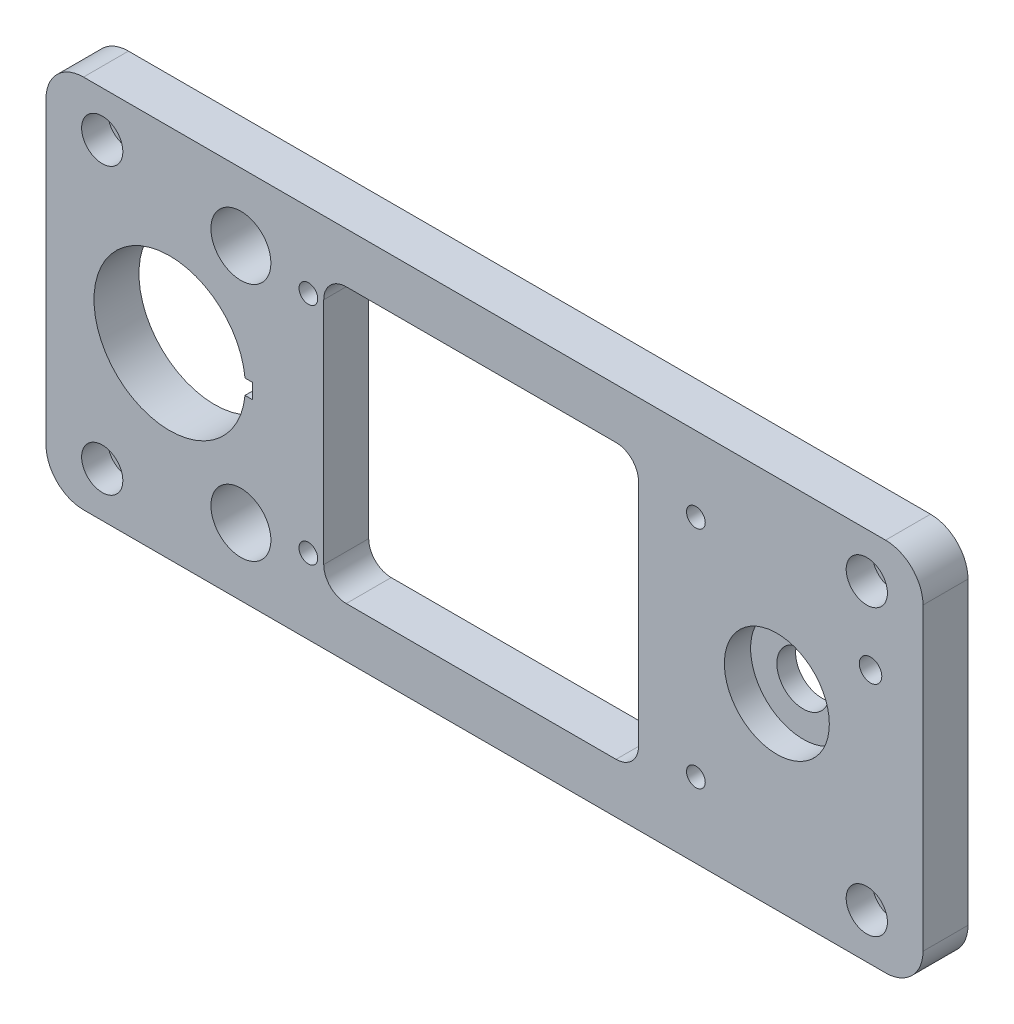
SolidWorks part; units mm, degrees
ref_plane "Front Plane" through (0, 0, 0) normal (0, 0, 1) x (1, 0, 0)
ref_plane "Top Plane" through (0, 0, 0) normal (0, 1, 0) x (1, 0, 0)
ref_plane "Right Plane" through (0, 0, 0) normal (1, 0, 0) x (0, 0, -1)
sketch "Sketch1" plane through (0, 0, 0) normal (0, 0, 1) x (1, 0, 0)
  line L0 (5, 0) -> (112, 0)
  line L1 (0, 5) -> (0, 45)
  line L2 (5, 50) -> (112, 50)
  line L3 (117, 45) -> (117, 5)
  line L4 (58.5, 50) -> (58.5, 0) construction
  line L5 (0, 25) -> (117, 25) construction
  line L6 (39.0504, 8.7001) -> (77.0504, 8.7001) construction
  line L7 (77.0504, 8.7001) -> (77.0504, 41.3001) construction
  line L8 (77.0504, 41.3001) -> (39.0504, 41.3001) construction
  line L9 (39.0504, 41.3001) -> (39.0504, 8.7001) construction
  line L10 (40.0504, 43.3001) -> (76.0504, 43.3001)
  line L11 (79.0504, 40.3001) -> (79.0504, 9.7001)
  line L12 (76.0504, 6.7001) -> (40.0504, 6.7001)
  line L13 (37.0504, 9.7001) -> (37.0504, 40.3001)
  line L14 (27.5504, 26) -> (26.5504, 26)
  line L15 (27.5504, 26) -> (27.5504, 24)
  line L16 (27.5504, 24) -> (26.5504, 24)
  line L17 (26, 41) -> (26, 2.6576) construction
  circle A0 centre (109.5, 44) radius 1.75
  circle A1 centre (7.5, 44) radius 1.75
  circle A2 centre (109.5, 6) radius 1.75
  circle A3 centre (7.5, 6) radius 1.75
  arc A4 (5, 0) -> (0, 5) centre (5, 5) cw
  arc A5 (112, 0) -> (117, 5) centre (112, 5) ccw
  arc A6 (117, 45) -> (112, 50) centre (112, 45) ccw
  arc A7 (5, 50) -> (0, 45) centre (5, 45) ccw
  circle A8 centre (97.5001, 24.9999) radius 3.5
  circle A9 centre (86.7004, 40) radius 1.25
  arc A10 (40.0504, 6.7001) -> (37.0504, 9.7001) centre (40.0504, 9.7001) cw
  circle A11 centre (86.7004, 10) radius 1.25
  circle A12 centre (35.0004, 10) radius 1.25
  circle A13 centre (35.0004, 40) radius 1.25
  arc A14 (79.0504, 9.7001) -> (76.0504, 6.7001) centre (76.0504, 9.7001) cw
  arc A15 (76.0504, 43.3001) -> (79.0504, 40.3001) centre (76.0504, 40.3001) cw
  arc A16 (40.0504, 43.3001) -> (37.0504, 40.3001) centre (40.0504, 40.3001) ccw
  circle A17 centre (110, 34) radius 1.5
  circle A18 centre (26, 41) radius 6 construction
  arc A19 (26.5504, 26) -> (26.5504, 24) centre (16.5, 25) ccw
  circle A20 centre (26, 9) radius 6 construction
  circle A21 centre (26, 41) radius 4
  circle A22 centre (26, 9) radius 4
  point P19 (0, 0)
  dimension "D1" = 51
  dimension "D2" = 19
  dimension "D3" = 5
  dimension "D4" = 38
  dimension "D10" = 3
  dimension "D11" = 7
  dimension "D12" = 16.5
  dimension "D16" = 10.1
  dimension "D15" = 26
  dimension "D5" = 32.6
  dimension "D6" = 2
  dimension "D7" = 2
  dimension "D8" = 2
  dimension "D9" = 2
  dimension "D13" = 1
  dimension "D14" = 1
extrude "Boss-Extrude1" add sketch "Sketch1" along normal blind 6
sketch "Sketch2" plane through (0, 0, 6) normal (0, 0, 1) x (1, 0, 0)
  circle A0 centre (7.5, 44) radius 2.75
  circle A1 centre (7.5, 6) radius 2.75
  circle A2 centre (109.5, 44) radius 2.75
  circle A3 centre (109.5, 6) radius 2.75
  circle A4 centre (97.5001, 24.9999) radius 7
extrude "Cut-Extrude1" cut sketch "Sketch2" against normal blind 3.5
